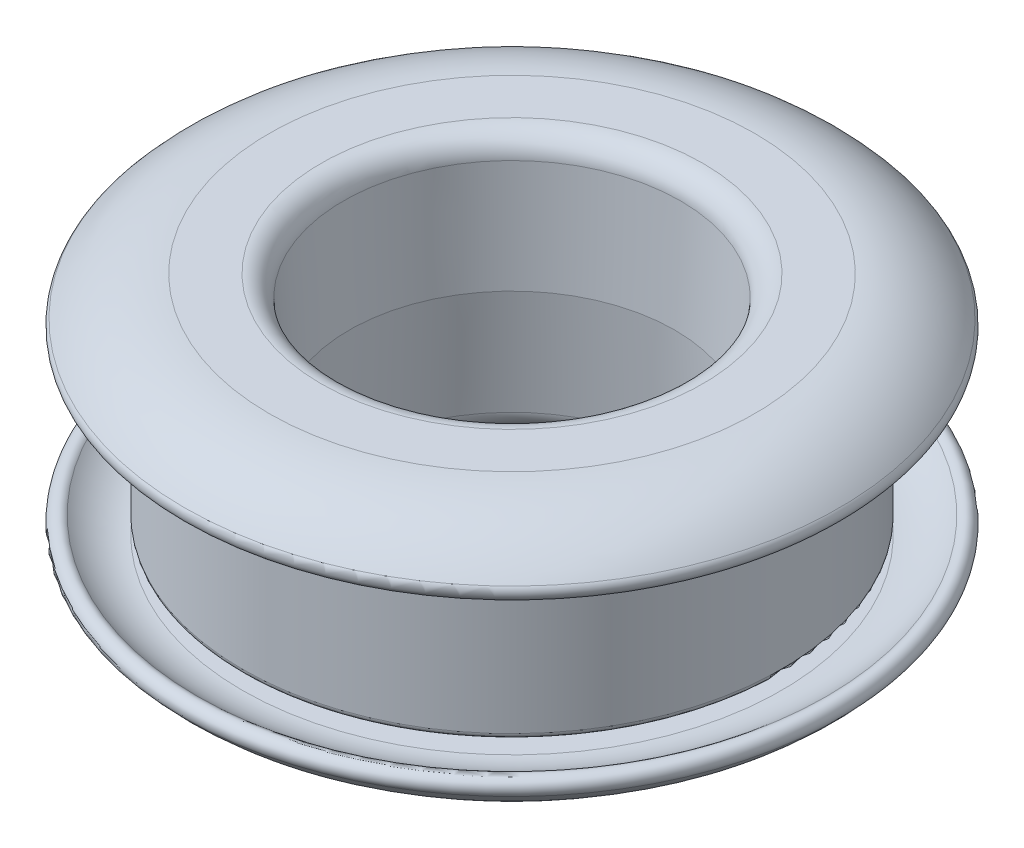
SolidWorks part; units mm, degrees
ref_plane "Front Plane" through (0, 0, 0) normal (0, 0, 1) x (1, 0, 0)
ref_plane "Top Plane" through (0, 0, 0) normal (0, 1, 0) x (1, 0, 0)
ref_plane "Right Plane" through (0, 0, 0) normal (1, 0, 0) x (0, 0, -1)
sketch "Sketch1" plane through (0, 0, 0) normal (0, 0, 1) x (1, 0, 0)
  line L0 (0, 0) -> (0, 46.445) construction
  line L1 (0, 0) -> (71.9029, 0) construction
  line L3 (18.4041, 0) -> (19.05, 12.3249)
  line L5 (30.48, 0) -> (30.48, 9.398)
  line L6 (30.48, 9.398) -> (24.8205, 9.398)
  line L7 (24.8205, 10.8417) -> (30.48, 10.8417)
  line L8 (24.8205, 10.8417) -> (24.8205, 9.398) construction
  line L9 (24.8205, 10.1198) -> (21.1246, 10.1198) construction
  line L10 (18.4041, 0) -> (30.48, 0)
  line L11 (21.5865, 14.732) -> (27.4445, 14.732)
  arc A0 (24.8205, 9.398) -> (24.8205, 10.8417) centre (24.13, 10.1198) cw
  arc A1 (30.48, 10.8417) -> (35.56, 8.89) centre (30.48, 3.2545) cw
  arc A2 (35.56, 8.89) -> (37.0149, 10.3021) centre (36.2403, 9.6447) ccw
  arc A3 (27.4445, 14.732) -> (37.0149, 10.3021) centre (27.4445, 2.1791) cw
  arc A4 (21.5865, 14.732) -> (19.05, 12.3249) centre (21.5865, 12.192) ccw
  point P24 (19.05, 14.4636)
  dimension "D4" = 0.9989
  dimension "D7" = 0.508
  dimension "D9" = 1.016
  dimension "D11" = 8.3988
  dimension "D12" = 2.54
  dimension "D1" = 60.96
  dimension "D2" = 38.1
  dimension "D3" = 18.796
  dimension "D5" = 1.4437
  dimension "D6" = 48.26
  dimension "D8" = 71.12
  dimension "D10" = 14.478
  dimension "D13" = 12.192
  dimension "D14" = 3
  dimension "D15" = 38.1
  dimension "D16" = 3.8903
revolve "Revolve1" add sketch "Sketch1" angle 360 about L0
fillet "Fillet1" radius 0.635 1 edges at (0, 9.398, -30.48)
mirror "Mirror1" about plane through (0, 0, 0) normal (0, 1, 0) of "Fillet1", "Revolve1"
